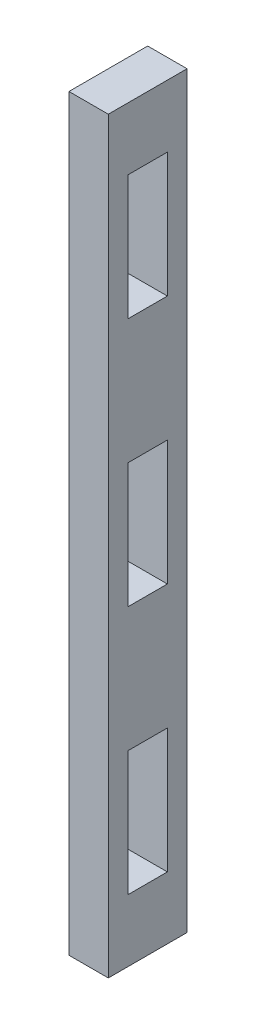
SolidWorks part; units mm, degrees
ref_plane "Front Plane" through (0, 0, 0) normal (0, 0, 1) x (1, 0, 0)
ref_plane "Top Plane" through (0, 0, 0) normal (0, 1, 0) x (1, 0, 0)
ref_plane "Right Plane" through (0, 0, 0) normal (1, 0, 0) x (0, 0, -1)
sketch "Sketch1" plane through (0, 0, 0) normal (1, 0, 0) x (0, 0, -1)
  line L1 (0, 0) -> (6.35, 0)
  line L2 (0, 0) -> (0, 60.325)
  line L3 (0, 60.325) -> (6.35, 60.325)
  line L4 (6.35, 0) -> (6.35, 60.325)
extrude "Boss-Extrude1" add sketch "Sketch1" along normal blind 3.175
sketch "Sketch2" plane through (3.175, 0, 0) normal (1, 0, 0) x (0, 0, -1)
  line L0 (3.175, 60.325) -> (3.175, 0) construction
  line L1 (6.35, 60.325) -> (0, 60.325) construction
  line L2 (0, 0) -> (6.35, 0) construction
  line L4 (1.5875, 15.0812) -> (4.7625, 15.0812)
  line L5 (1.5875, 15.0812) -> (1.5875, 5.0271)
  line L6 (1.5875, 5.0271) -> (4.7625, 5.0271)
  line L7 (4.7625, 15.0812) -> (4.7625, 5.0271)
  line L8 (1.5875, 15.0812) -> (4.7625, 5.0271) construction
  line L9 (1.5875, 5.0271) -> (4.7625, 15.0812) construction
  line L29 (1.5875, 81.1212) -> (1.5875, 71.0671)
  line L30 (1.5875, 81.1212) -> (4.7625, 81.1212)
  line L31 (4.7625, 81.1212) -> (4.7625, 71.0671)
  line L32 (1.5875, 71.0671) -> (4.7625, 71.0671)
  line L41 (1.5875, 48.1012) -> (1.5875, 38.0471)
  line L42 (1.5875, 38.0471) -> (4.7625, 38.0471)
  line L43 (4.7625, 48.1012) -> (4.7625, 38.0471)
  line L44 (1.5875, 48.1012) -> (4.7625, 48.1012)
  point P6 (3.175, 10.0542)
extrude "Cut-Extrude1" cut sketch "Sketch2" against normal through all
pattern_linear "LPattern1" count 3 spacing 20.1083 along (0, 1, 0) of "Cut-Extrude1"
sketch "Sketch3" plane through (3.175, 0, 0) normal (1, 0, 0) x (0, 0, -1)
  line L8 (-0.254, 60.579) -> (-0.254, -0.254)
  line L9 (-0.254, -0.254) -> (6.604, -0.254)
  line L10 (6.604, -0.254) -> (6.604, 60.579)
  line L11 (6.604, 60.579) -> (-0.254, 60.579)
  line L12 (-0.254, 60.579) -> (-0.254, -0.254)
  line L13 (-0.254, -0.254) -> (6.604, -0.254)
  line L14 (6.604, -0.254) -> (6.604, 60.579)
  line L15 (6.604, 60.579) -> (-0.254, 60.579)
  line L20 (1.8415, 55.0439) -> (1.8415, 45.4977)
  line L21 (4.5085, 45.4977) -> (4.5085, 55.0439)
  line L22 (4.5085, 55.0439) -> (1.8415, 55.0439)
  line L23 (1.8415, 45.4977) -> (4.5085, 45.4977)
  line L24 (1.8415, 55.0439) -> (1.8415, 45.4977)
  line L25 (4.5085, 45.4977) -> (4.5085, 55.0439)
  line L26 (4.5085, 55.0439) -> (1.8415, 55.0439)
  line L27 (1.8415, 45.4977) -> (4.5085, 45.4977)
  line L35 (4.5085, 25.3894) -> (4.5085, 34.9356)
  line L36 (1.8415, 25.3894) -> (4.5085, 25.3894)
  line L37 (1.8415, 34.9356) -> (1.8415, 25.3894)
  line L38 (4.5085, 34.9356) -> (1.8415, 34.9356)
  line L39 (4.5085, 25.3894) -> (4.5085, 34.9356)
  line L40 (1.8415, 25.3894) -> (4.5085, 25.3894)
  line L41 (1.8415, 34.9356) -> (1.8415, 25.3894)
  line L42 (4.5085, 34.9356) -> (1.8415, 34.9356)
  line L47 (1.8415, 5.2811) -> (4.5085, 5.2811)
  line L48 (4.5085, 5.2811) -> (4.5085, 14.8272)
  line L49 (1.8415, 14.8272) -> (1.8415, 5.2811)
  line L50 (4.5085, 14.8272) -> (1.8415, 14.8272)
  line L51 (1.8415, 5.2811) -> (4.5085, 5.2811)
  line L52 (4.5085, 5.2811) -> (4.5085, 14.8272)
  line L53 (1.8415, 14.8272) -> (1.8415, 5.2811)
  line L54 (4.5085, 14.8272) -> (1.8415, 14.8272)
  dimension "D1" = 0.254
  dimension "D2" = 0.254
  dimension "D3" = 0.254
  dimension "D4" = 0.254
equation "\"t\"= .125in"
equation "\"ht\"= 2.5in"
equation "\"Nt\"= 3"
equation "\"HeightSideSupport@Sketch1\" = \"ht\" - \"t\""
equation "\"WidthSideSupport@Sketch1\"= 2 * \"t\""
equation "\"D1@Boss-Extrude1\"= \"t\""
equation "\"SlotHeight@Sketch2\" = ( \"ht\" - \"t\" ) / 2 / \"Nt\""
equation "\"SlotHeightToo@Sketch2\" = ( \"ht\" - \"t\" ) / 2 / \"Nt\""
equation "\"SlotWidth@Sketch2\"= \"t\""
equation "\"NumberOfSlots@Sketch2\"= \"Nt\""
equation "\"D1@LPattern1\"= \"Nt\""
equation "\"D3@LPattern1\"= ( \"ht\" - \"t\" ) / \"Nt\""
